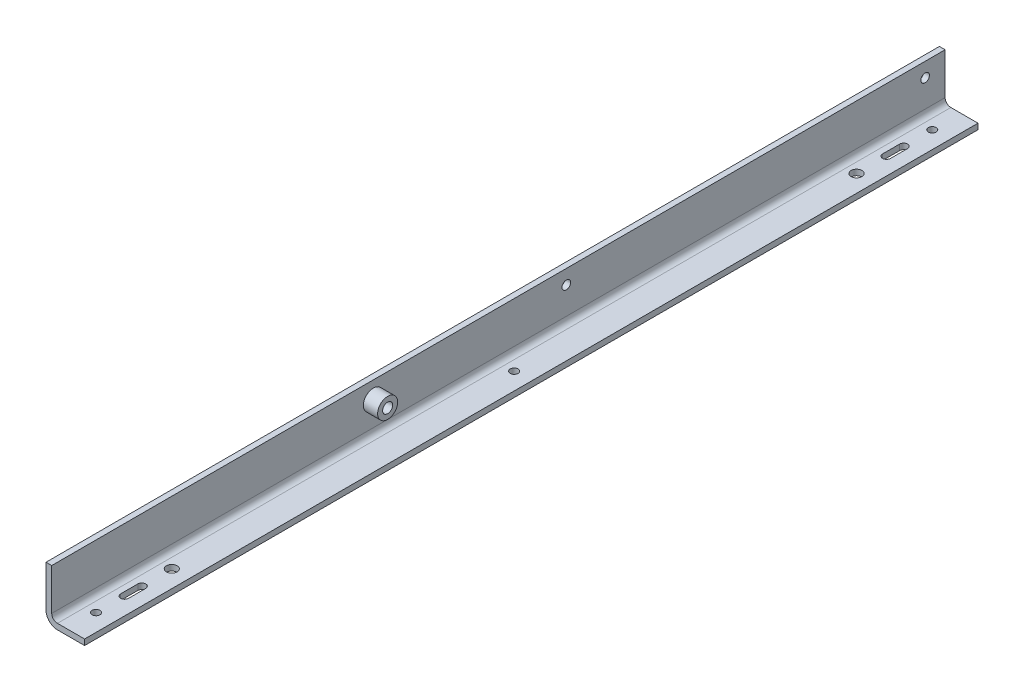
SolidWorks part; units mm, degrees
ref_plane "Спереди" through (0, 0, 0) normal (0, 0, 1) x (1, 0, 0)
ref_plane "Сверху" through (0, 0, 0) normal (0, 1, 0) x (1, 0, 0)
ref_plane "Справа" through (0, 0, 0) normal (1, 0, 0) x (0, 0, -1)
sketch "Эскиз1" plane through (0, 0, 0) normal (0, 0, 1) x (1, 0, 0)
  line L0 (8, 4) -> (27, 4)
  line L1 (8, 0) -> (27, 0)
  line L2 (0, 8) -> (0, 37)
  line L3 (0, 37) -> (27, 37) construction
  line L4 (27, 0) -> (27, 37) construction
  line L5 (4, 8) -> (4, 37)
  line L6 (4, 4) -> (4, 37) construction
  line L7 (4, 4) -> (27, 4) construction
  line L8 (0, 0) -> (27, 0) construction
  line L9 (0, 0) -> (0, 37) construction
  line L10 (0, 37) -> (4, 37)
  line L11 (27, 4) -> (27, 0)
  arc A0 (4, 8) -> (8, 4) centre (8, 8) ccw
  arc A1 (8, 0) -> (0, 8) centre (8, 8) cw
  point P14 (0, 0)
  dimension "D4" = 4
  dimension "D5" = 8
  dimension "D1" = 27
  dimension "D2" = 37
  dimension "D3" = 4
extrude "Бобышка-Вытянуть1" add sketch "Эскиз1" along normal blind 625
sketch "Эскиз2" plane through (4, 0, 0) normal (1, 0, 0) x (0, 0, -1)
  line L0 (-625, 27) -> (0, 27) construction
  line L1 (-625, 8) -> (-625, 37) construction
  line L2 (0, 8) -> (0, 37) construction
  line L3 (-625, 37) -> (0, 37) construction
  circle A0 centre (-265, 27) radius 3
  circle A1 centre (-14, 27) radius 3
  circle A2 centre (-400, 25) radius 3.5
  dimension "D4" = 6
  dimension "D5" = 6
  dimension "D8" = 7
  dimension "D1" = 265
  dimension "D2" = 14
  dimension "D3" = 10
  dimension "D6" = 12
  dimension "D7" = 400
extrude "Вырез-Вытянуть1" cut sketch "Эскиз2" against normal through all
sketch "Эскиз3" plane through (4, 0, 0) normal (1, 0, 0) x (0, 0, -1)
  circle A0 centre (-400, 25) radius 3.5
  circle A1 centre (-400, 25) radius 3.5 construction
  circle A2 centre (-400, 25) radius 7
  dimension "D1" = 3.5
extrude "Бобышка-Вытянуть2" add sketch "Эскиз3" along normal blind 10
sketch "Эскиз4" plane through (0, 0, 0) normal (0, -1, 0) x (1, 0, 0)
  line L0 (15, 625) -> (15, 0) construction
  line L1 (27, 625) -> (27, 0) construction
  line L2 (15, 585) -> (15, 573) construction
  line L3 (17.75, 585) -> (17.75, 573)
  line L4 (12.25, 585) -> (12.25, 573)
  line L5 (8, 625) -> (27, 625) construction
  line L6 (15, 312.5) -> (144.4337, 312.5) construction
  line L7 (15, 40) -> (15, 52) construction
  line L8 (17.75, 40) -> (17.75, 52)
  line L9 (12.25, 40) -> (12.25, 52)
  circle A0 centre (15, 605) radius 2.75
  circle A1 centre (15, 552) radius 3.75
  circle A2 centre (15, 312.5) radius 2.75
  arc A3 (17.75, 585) -> (12.25, 585) centre (15, 585) ccw
  arc A4 (12.25, 573) -> (17.75, 573) centre (15, 573) ccw
  arc A5 (17.75, 40) -> (12.25, 40) centre (15, 40) cw
  arc A6 (12.25, 52) -> (17.75, 52) centre (15, 52) cw
  circle A7 centre (15, 73) radius 3.75
  circle A8 centre (15, 20) radius 2.75
  point P12 (15, 579)
  point P22 (15, 46)
  dimension "D2" = 5.5
  dimension "D3" = 7.5
  dimension "D9" = 5.5
  dimension "D1" = 12
  dimension "D4" = 5.5
  dimension "D5" = 12
  dimension "D6" = 20
  dimension "D7" = 73
  dimension "D8" = 46
extrude "Вырез-Вытянуть2" cut sketch "Эскиз4" against normal through all
move or copy body "Тело-Переместить/Копировать2" [suppressed] bodies to move or copy 106
move or copy body "Тело-Переместить/Копировать1" [suppressed] bodies to move or copy 106
